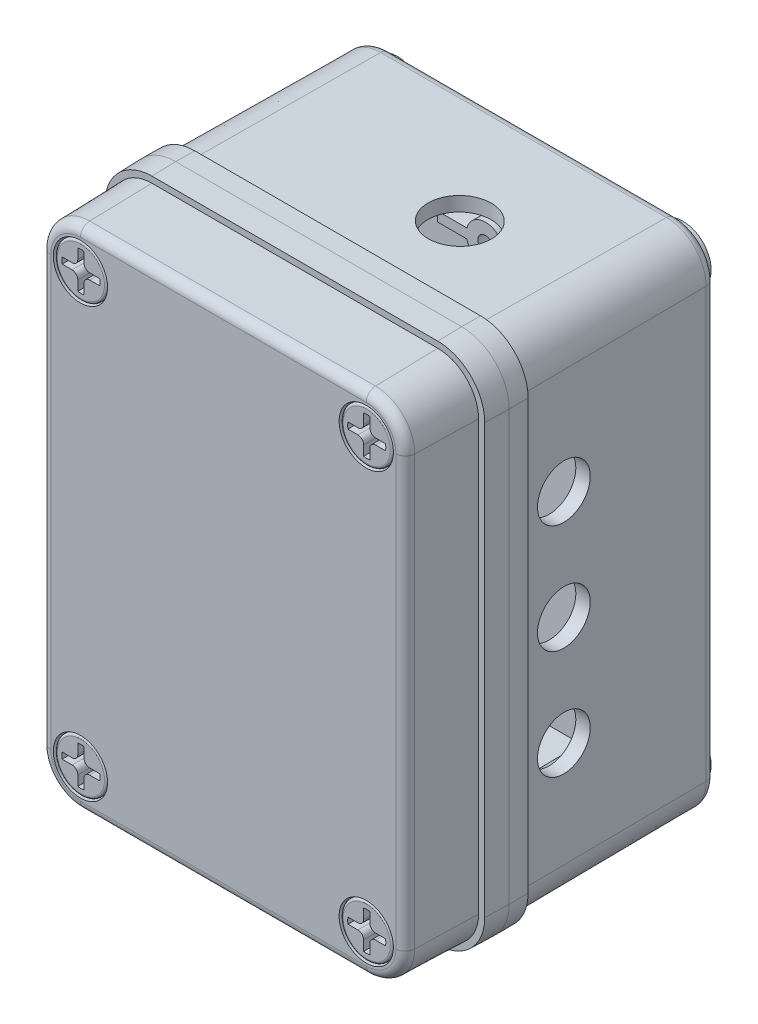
SolidWorks part; units mm, degrees
ref_plane "Front Plane" through (0, 0, 0) normal (0, 0, 1) x (1, 0, 0)
ref_plane "Top Plane" through (0, 0, 0) normal (0, 1, 0) x (1, 0, 0)
ref_plane "Right Plane" through (0, 0, 0) normal (1, 0, 0) x (0, 0, -1)
sketch "Sketch1" plane through (0, 0, 0) normal (0, 0, 1) x (1, 0, 0)
  line L0 (30.0012, 45.0355) -> (-30.0012, 45.0355) construction
  line L1 (-39.9656, 54.9999) -> (39.9656, 54.9999) construction
  line L2 (-39.9656, 54.9999) -> (-39.9656, -54.9999) construction
  line L3 (-39.9656, -54.9999) -> (39.9656, -54.9999) construction
  line L4 (39.9656, 54.9999) -> (39.9656, -54.9999) construction
  line L5 (-39.9656, 54.9999) -> (39.9656, -54.9999) construction
  line L6 (-39.9656, -54.9999) -> (39.9656, 54.9999) construction
  line L7 (-35.3339, 50.3339) -> (35.3339, 50.3339) construction
  line L8 (-35.3339, 50.3339) -> (-35.3339, -50.3339) construction
  line L9 (-35.3339, -50.3339) -> (35.3339, -50.3339) construction
  line L10 (35.3339, 50.3339) -> (35.3339, -50.3339) construction
  line L11 (-35.3339, 50.3339) -> (35.3339, -50.3339) construction
  line L12 (-35.3339, -50.3339) -> (35.3339, 50.3339) construction
  line L13 (-30.0012, 45.0355) -> (-30.0012, -45.0355) construction
  line L14 (-30.0012, -45.0355) -> (30.0012, -45.0355) construction
  line L15 (30.0012, -45.0355) -> (30.0012, 45.0355) construction
  circle A0 centre (30.0012, 45.0355) radius 2.2504
  circle A1 centre (-30.0012, 45.0355) radius 2.2504
  circle A2 centre (-30.0012, -45.0355) radius 2.2504
  circle A3 centre (30.0012, -45.0355) radius 2.2504
  point P4 (0, 0)
  point P11 (0, 0)
  point P20 (0, 45.0355)
  point P21 (30.0012, 0)
  dimension "D1" = 9.9644
  dimension "Mounting Hole Diameter" = 4.5009
  dimension "Width" = 79.9313
  dimension "Height" = 109.9998
  dimension "Inside Height" = 100.6678
  dimension "Inside Width" = 70.6679
  dimension "D2" = 9.9644
sketch "Sketch2" plane through (0, 0, 0) normal (1, 0, 0) x (0, 0, -1)
  line L1 (-33.2499, 54.9999) -> (33.2499, 54.9999) construction
  line L2 (-33.2499, 54.9999) -> (-33.2499, -54.9999) construction
  line L3 (-33.2499, -54.9999) -> (33.2499, -54.9999) construction
  line L4 (33.2499, 54.9999) -> (33.2499, -54.9999) construction
  line L5 (-33.2499, 54.9999) -> (33.2499, -54.9999) construction
  line L6 (-33.2499, -54.9999) -> (33.2499, 54.9999) construction
  line L11 (-30.2501, 50.3339) -> (28.749, 50.3339) construction
  line L12 (-30.2501, 50.3339) -> (-30.2501, -50.3339) construction
  line L13 (-30.2501, -50.3339) -> (28.749, -50.3339) construction
  line L14 (28.749, 50.3339) -> (28.749, -50.3339) construction
  line L15 (-30.2501, 50.3339) -> (28.749, -50.3339) construction
  line L16 (-30.2501, -50.3339) -> (28.749, 50.3339) construction
  point P4 (0, 0)
  point P7 (0, 54.9999)
  point P12 (0, 0)
  point P14 (-0.7506, 0)
  dimension "Depth" = 66.4997
  dimension "Inside Depth" = 58.9991
  dimension "Lid Thickness" = 2.9997
imported_body "Imported1"
imported_body "Imported2"
imported_body "Imported3"
imported_body "Imported4"
imported_body "Imported5"
imported_body "Imported6"
sketch "Sketch4" plane through (38.5814, 0, -0.3367) normal (1, 0, -0.0087) x (-0.0087, 0, -1)
  line L0 (-0.6971, -22.86) -> (-0.6971, 0) construction
  line L1 (-0.6971, 0) -> (-0.6971, 22.86) construction
  line L2 (-9.5871, 45) -> (-9.5871, -45) construction
  line L3 (-0.6971, 0) -> (-9.5871, 0) construction
  circle A0 centre (-0.6971, 0) radius 5.588
  circle A1 centre (-0.6971, 22.86) radius 5.588
  circle A2 centre (-0.6971, -22.86) radius 5.588
  circle A3 centre (-0.6971, -22.86) radius 8.89 construction
  circle A4 centre (-0.6971, 0) radius 8.89 construction
  circle A5 centre (-0.6971, 22.86) radius 8.89 construction
  dimension "D2" = 17.78
  dimension "D3" = 11.176
  dimension "D1" = 22.86
extrude "Cut-Extrude1" cut sketch "Sketch4" against normal blind 5.08
sketch "Sketch5" plane through (0, 53.5803, -0.4676) normal (0, 1, -0.0087) x (1, 0, 0)
  line L0 (9.1208, 19.492) -> (9.1208, 21.016) construction
  line L1 (-30, -9.718) -> (30, -9.718) construction
  line L2 (21.6335, 28.3097) -> (21.9799, -11.3918) construction
  circle A0 centre (9.1208, 6.792) radius 6.604
  circle A1 centre (9.1208, 6.792) radius 12.7 construction
  point P7 (8.4638, 6.792)
  dimension "D1" = 25.4
  dimension "D2" = 13.208
  dimension "D3" = 1.524
  dimension "D4" = 16.51
  dimension "D5" = 12.7
extrude "Cut-Extrude2" cut sketch "Sketch5" against normal blind 5.08
